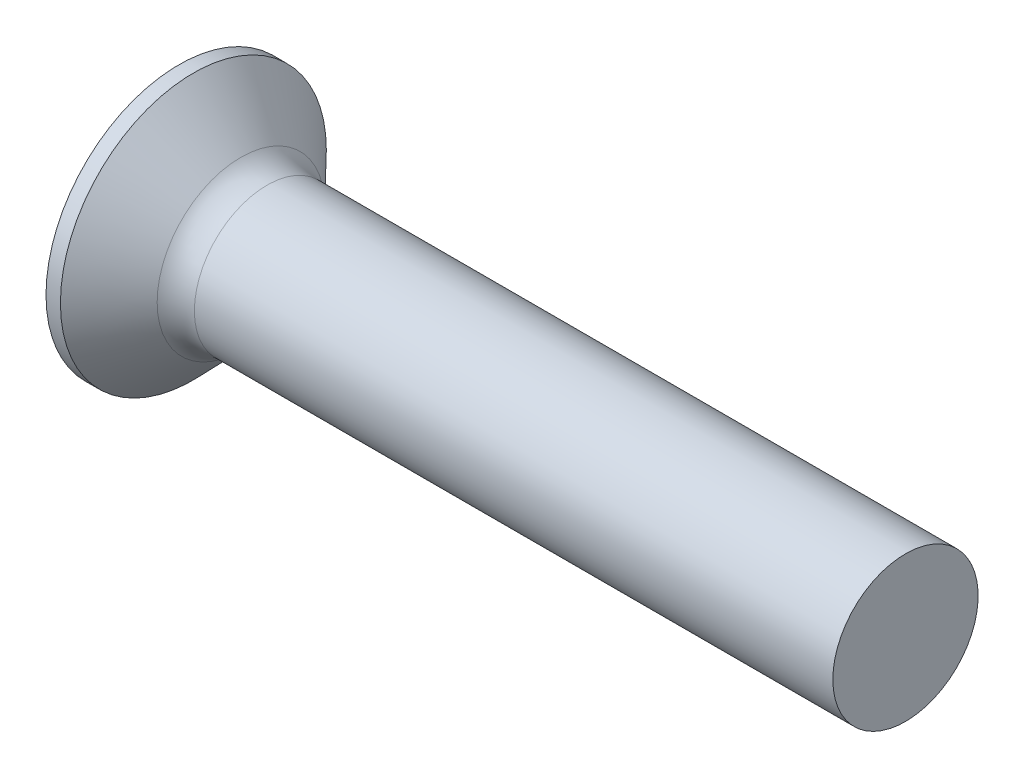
SolidWorks part; units mm, degrees
ref_plane "Plane1" through (0, 0, 0) normal (0, 0, 1) x (1, 0, 0)
ref_plane "Plane2" through (0, 0, 0) normal (0, 1, 0) x (1, 0, 0)
ref_plane "Plane3" through (0, 0, 0) normal (1, 0, 0) x (0, 0, -1)
other "Configuration Table"
sketch "BodySke" plane through (0, 0, 0) normal (0, 0, 1) x (1, 0, 0)
  line L0 (0, 0) -> (52.3, 0)
  line L1 (52.3, 0) -> (52.3, 5)
  line L2 (52.3, 5) -> (7.3, 5)
  line L3 (3.2924, -9.15) -> (7.3, -5) construction
  line L4 (-15.875, 0) -> (82.55, 0) construction
  line L5 (3.2924, 9.15) -> (7.3, 5)
  line L6 (8.8, 8.175) -> (8.8, -7.7) construction
  line L7 (2.3, 2.7793) -> (2.3, -13.0957) construction
  line L8 (3.2924, 9.15) -> (2.3, 9.15)
  arc A0 (0, 0) -> (2.3, 9.15) centre (19.3505, 0) cw
revolve "Base-Revolve" add sketch "BodySke" angle 360 about L4
fillet "Fillet1" radius 2.5 1 edges at (7.3, 0, 5)
sketch "Sketch3" plane through (0, 0, 0) normal (1, 0, 0) x (0, 0, -1)
  line L0 (1.08, -5.15) -> (-1.08, -5.15)
  line L1 (1.08, -5.15) -> (1.08, 5.15)
  line L2 (-1.08, 5.15) -> (1.08, 5.15)
  line L3 (-1.08, 5.15) -> (-1.08, -5.15)
ref_plane "Plane4" through (6.05, 0, 0) normal (1, 0, 0) x (0, 0, -1)
sketch "Sketch4" plane through (6.05, 0, 0) normal (1, 0, 0) x (0, 0, -1)
  line L0 (1.08, -2.1336) -> (-1.08, -2.1336)
  line L1 (1.08, -2.1336) -> (1.08, 2.1336)
  line L2 (-1.08, 2.1336) -> (1.08, 2.1336)
  line L3 (-1.08, 2.1336) -> (-1.08, -2.1336)
loft "Recess" cut profiles "Sketch3", "Sketch4"
pattern_circular "RecPat" count 2 every 90 about axis through (0, 0, 0) along (1, 0, 0) of "Recess"
sketch "RecCorSke" plane through (0, 0, 0) normal (0, 0, 1) x (1, 0, 0)
  line L0 (-3.175, 0) -> (15.875, 0) construction
  line L2 (0, 0) -> (0, 2.3536)
  line L3 (0, 2.3536) -> (6.05, 1.9305)
  line L4 (6.05, 1.9305) -> (6.6773, 0)
  line L5 (6.6773, 0) -> (0, 0)
revolve "RecessCore" cut sketch "RecCorSke" angle 360 about L0
sketch "ThdSchSke" plane through (0, 0, 0) normal (0, 0, 1) x (1, 0, 0)
  line L0 (8.8, -4.172) -> (8.2202, -5)
  line L1 (8.8, -4.172) -> (9.3798, -5)
  line L2 (9.3798, -5) -> (9.3798, -6.25)
  line L3 (-3.175, 0) -> (5.1513, 0) construction
  line L5 (9.3798, -6.25) -> (8.2202, -6.25)
  line L6 (8.2202, -6.25) -> (8.2202, -5)
revolve "ThreadSchematic" [suppressed] cut sketch "ThdSchSke" angle 360 about L3
pattern_linear "ThdSchPat" [suppressed]
equation "\"D1@Sketch3\" = \"Cross_width@Sketch3\" / 2"
equation "\"D2@Sketch3\" = \"Cross_dia@Sketch3\" / 2"
equation "\"Depth@RecCorSke\" = \"Cross_depth@Plane4\""
equation "\"D1@Sketch4\" = \"Cross_width@Sketch3\""
equation "\"D2@Sketch4\" = \"Cross_dia@Sketch3\" - 2.0 * \"Cross_depth@Plane4\" * tan(26.5  * 0.017453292)"
equation "\"D3@Sketch4\" = \"D1@Sketch4\" / 2"
equation "\"D4@Sketch4\" = \"D2@Sketch4\" / 2"
equation "\"Thread_length@ThreadCosmetic\" = ((sgn( (\"Length@BodySke\" - \"Advance@BodySke\" - \"Side_ht@BodySke\" ) - \"Thread_nom@BodySke\" )-1)*( (\"Length@BodySke\" - \"Advance@BodySke\" - \"Side_ht@BodySke\" ) - \"Thread_"
equation "\"Thread_minor@ThdSchSke\" = \"Thread_minor@ThreadCosmetic\""
equation "\"Diameter@ThdSchSke\" = \"Diameter@BodySke\""
equation "\"Overcut@ThdSchSke\" = \"Diameter@BodySke\" * 1.25"
equation "\"Start@ThdSchSke\" = \"Oval_ht@BodySke\" + \"Length@BodySke\" - \"Thread_length@ThreadCosmetic\"  '---Countersunk---"
equation "\"Num_threads@ThdSchPat\" = int( \"Thread_length@ThreadCosmetic\" / \"Advance@BodySke\" + 0.999 )  + 1"
equation "\"Advance@ThdSchPat\" = \"Thread_length@ThreadCosmetic\" /  (\"Num_threads@ThdSchPat\" - 1) 'relax it"
